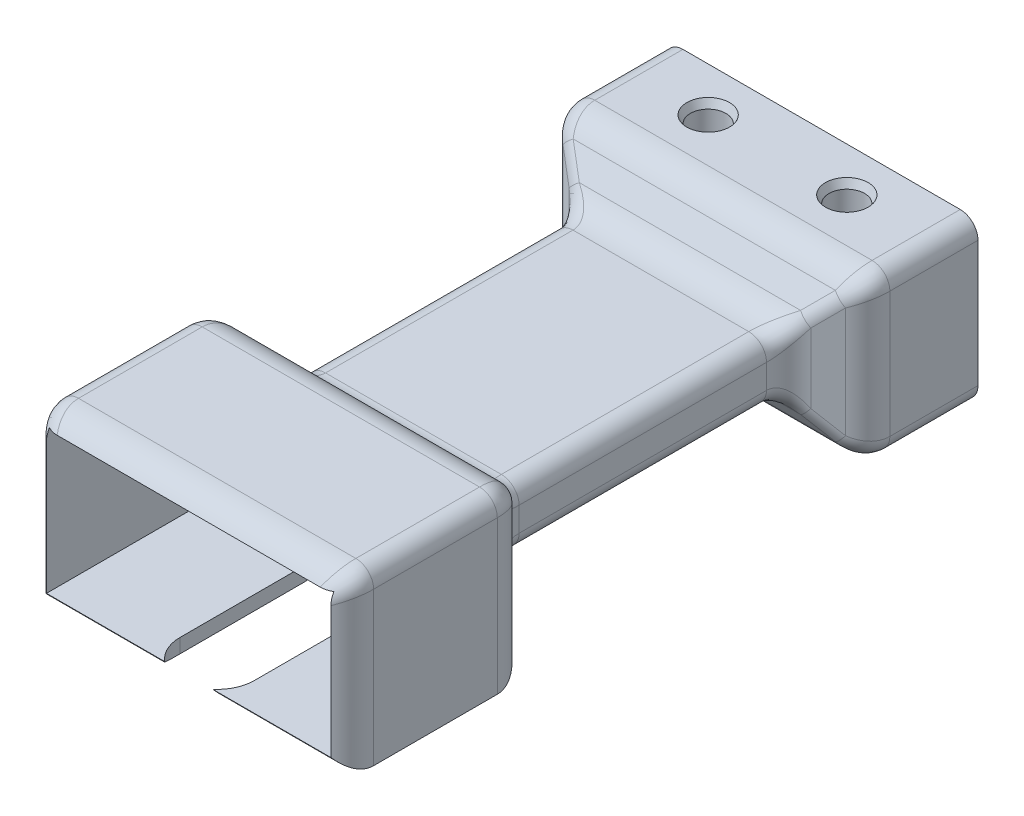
SolidWorks part; units mm, degrees
ref_plane "Front Plane" through (0, 0, 0) normal (0, 0, 1) x (1, 0, 0)
ref_plane "Top Plane" through (0, 0, 0) normal (0, 1, 0) x (1, 0, 0)
ref_plane "Right Plane" through (0, 0, 0) normal (1, 0, 0) x (0, 0, -1)
sketch "Sketch1" plane through (0, 0, 0) normal (0, 0, 1) x (1, 0, 0)
  line L1 (0, 0) -> (40, 0)
  line L2 (0, 0) -> (0, 20)
  line L3 (0, 20) -> (40, 20)
  line L4 (40, 0) -> (40, 20)
  dimension "D1" = 40
  dimension "D2" = 20
extrude "Extrude-Thin3" add sketch "Sketch1" along normal blind 25 thin
sketch "Sketch3" plane through (0, 0, 0) normal (0, 0, -1) x (-1, 0, 0)
  line L1 (-42, 22) -> (2, 22)
  line L2 (-42, 22) -> (-42, -2)
  line L3 (-42, -2) -> (2, -2)
  line L4 (2, 22) -> (2, -2)
extrude "Boss-Extrude1" add sketch "Sketch3" along normal blind 5 draft 55
sketch "Sketch4" plane through (0, 0, -5) normal (0, 0, -1) x (-1, 0, 0)
  line L0 (-5.1407, 5.1407) -> (-5.1407, 14.8593) construction
  line L1 (-34.8593, 14.8593) -> (-5.1407, 14.8593)
  line L2 (-34.8593, 14.8593) -> (-34.8593, 6.4454)
  line L3 (-34.8593, 6.4454) -> (-5.1407, 6.4454)
  line L4 (-5.1407, 14.8593) -> (-5.1407, 6.4454)
extrude "Boss-Extrude3" add sketch "Sketch4" along normal blind 40
sketch "Sketch6" plane through (0, 0, -45) normal (0, 0, -1) x (-1, 0, 0)
  line L1 (-34.8593, 14.8593) -> (-5.1407, 14.8593)
  line L2 (-34.8593, 14.8593) -> (-34.8593, 6.4454)
  line L3 (-34.8593, 6.4454) -> (-5.1407, 6.4454)
  line L4 (-5.1407, 14.8593) -> (-5.1407, 6.4454)
extrude "Boss-Extrude4" add sketch "Sketch6" along normal blind 5 draft 55
sketch "Sketch7" plane through (0, 0, -50) normal (0, 0, -1) x (-1, 0, 0)
  line L1 (-42, 22) -> (2, 22)
  line L2 (-42, 22) -> (-42, -0.6954)
  line L3 (-42, -0.6954) -> (2, -0.6954)
  line L4 (2, 22) -> (2, -0.6954)
extrude "Boss-Extrude6" add sketch "Sketch7" along normal blind 15
fillet "Fillet69" radius 5 20 edges at (20, -2, 25) (-2, 10, 25) (42, 10, 25) (20, 22, 25) (20, -0.6954, -50) (42, 10.6523, -50) (20, 22, -50) (-2, 10.6523, -50) (42, 10, 0) (20, -2, 0) (-2, 10, 0) (20, 22, 0) (20, 5.1407, -5) (5.1407, 10.6523, -5) (34.8593, 10.6523, -5) (20, 14.8593, -5) (34.8593, 10.6523, -45) (20, 6.4454, -45) (5.1407, 10.6523, -45) (20, 14.8593, -45)
sketch "Sketch9" plane through (0, -2, 0) normal (0, -1, 0) x (1, 0, 0)
  line L0 (20, 20) -> (20, -11.9346) construction
  line L1 (42, 20) -> (-2, 20) construction
  line L2 (25.2383, 20) -> (25.2383, -11.9346)
  line L3 (14.7617, 20) -> (14.7617, -11.9346)
  arc A0 (25.2383, 20) -> (14.7617, 20) centre (20, 20) ccw
  arc A1 (14.7617, -11.9346) -> (25.2383, -11.9346) centre (20, -11.9346) ccw
  point P4 (20, 4.0327)
  point P9 (20, 20)
extrude "Cut-Extrude5" cut sketch "Sketch9" against normal blind 12
fillet "Fillet71" radius 2.5 32 edges at (-2, -0.6954, -58.8014) (-1.4351, -0.1304, -50.2941) (1.5704, 2.875, -47.5) (4.5758, 5.8804, -44.7059) (4.5758, 6.4454, -5.2941) (42, -0.6954, -58.8014) (41.4351, -0.1304, -50.2941) (38.4296, 2.875, -47.5) (35.4242, 5.8804, -44.7059) (35.4242, 6.4454, -5.2941) (42, 22, -58.8014) (41.4351, 21.4351, -50.2941) (38.4296, 18.4296, -47.5) (35.4242, 15.4242, -44.7059) (41.4721, 21.4721, 22.2361) (42, 22, 11.3014) (41.4351, 21.4351, 0.2941) (38.4296, 18.4296, -2.5) (35.4242, 15.4242, -5.2941) (-2, 22, -58.8014) (-1.4351, 21.4351, -50.2941) (1.5704, 18.4296, -47.5) (4.5758, 15.4242, -44.7059) (-1.4721, 21.4721, 22.2361) (-2, 22, 11.3014) (-1.4351, 21.4351, 0.2941) (1.5704, 18.4296, -2.5) (4.5758, 15.4242, -5.2941) (5.1407, 6.4454, -25) (34.8593, 6.4454, -25) (34.8593, 14.8593, -25) (5.1407, 14.8593, -25)
sketch "Sketch10" plane through (0, -0.6954, 0) normal (0, -1, 0) x (1, 0, 0)
  line L0 (39.5, -65) -> (0.5, -65) construction
  line L1 (20, -65) -> (20, -52.6028)
  line L2 (39.5, -52.6028) -> (0.5, -52.6028) construction
  line L3 (20, -65) -> (39.5, -52.6028) construction
  line L4 (20, -65) -> (0.5, -52.6028) construction
  line L5 (0.5, -65) -> (20, -52.6028) construction
  line L6 (39.5, -65) -> (20, -52.6028) construction
  circle A0 centre (29.75, -58.8014) radius 2.5
  circle A1 centre (10.25, -58.8014) radius 2.5
  dimension "D1" = 5
  dimension "D2" = 5
sketch "Sketch15" plane through (0, 22, 0) normal (0, 1, 0) x (1, 0, 0)
  line L0 (20, 65) -> (20, 52.6028)
  line L1 (0.5, 65) -> (39.5, 65) construction
  line L2 (0.5, 52.6028) -> (39.5, 52.6028) construction
  line L3 (20, 65) -> (0.5, 52.6028) construction
  line L4 (0.5, 65) -> (20, 52.6028) construction
  line L5 (39.5, 65) -> (20, 52.6028) construction
  line L6 (20, 65) -> (39.5, 52.6028) construction
  circle A0 centre (10.25, 58.8014) radius 2.5
  circle A1 centre (29.75, 58.8014) radius 2.5
  dimension "D1" = 5
  dimension "D2" = 5
hole_wizard "Hole2" positions "3DSketch7" profile "Sketch21" legacy
sketch3d "3DSketch7"
  point P0 (10.25, 22, -58.8014)
  point P3 (29.75, 22, -58.8014)
  point P6 (29.75, -0.6954, -58.8014)
  point P9 (10.25, -0.6954, -58.8014)
sketch "Sketch21" plane through (10.25, 22, -58.8014) normal (1, 0, 0) x (0, 0, 1)
  line L0 (0, 0) -> (0, 24)
  line L1 (0, 24) -> (2.5, 24)
  line L2 (2.5, 24) -> (2.5, 1.0723)
  line L3 (2.5, 1.0723) -> (3, 0)
  line L4 (3, 0) -> (0, 0)
  line L5 (0, -6.4453) -> (0, 115.525) construction
  line L6 (-2.5, 1.0723) -> (-3, 0) construction
  dimension "Diameter" = 5
  dimension "Depth" = 24
  dimension "C-Sink Angle" = 50
  dimension "C-Sink Diameter" = 6
fillet "Fillet72" radius 1 3 edges at (14.7617, 6.4454, -8.4673) (20, 6.4454, -17.1729) (25.2383, 6.4454, -8.4673)
